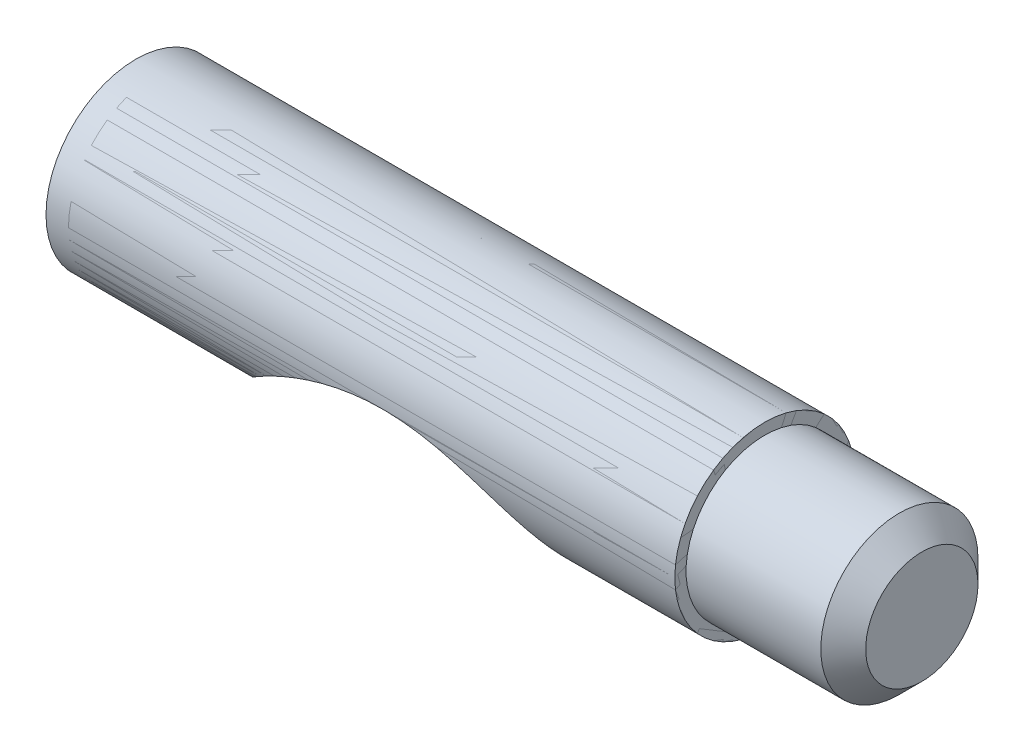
SolidWorks part; units mm, degrees
ref_plane "Face" through (0, 0, 0) normal (0, 0, 1) x (1, 0, 0)
ref_plane "Dessus" through (0, 0, 0) normal (0, 1, 0) x (1, 0, 0)
ref_plane "Droite" through (0, 0, 0) normal (1, 0, 0) x (0, 0, -1)
imported_body " Importée1"
sketch "Esquisse1" plane through (1.0218, 0, 0) normal (1, 0, 0) x (0, 0, -1)
  circle A0 centre (0, 0) radius 1.75
extrude "Boss.-Extru.1" add sketch "Esquisse1" along normal blind 3.5
chamfer "Chanfrein1" distance 0.5 angle 45
chamfer "Chanfrein2" distance 0.5 angle 45
